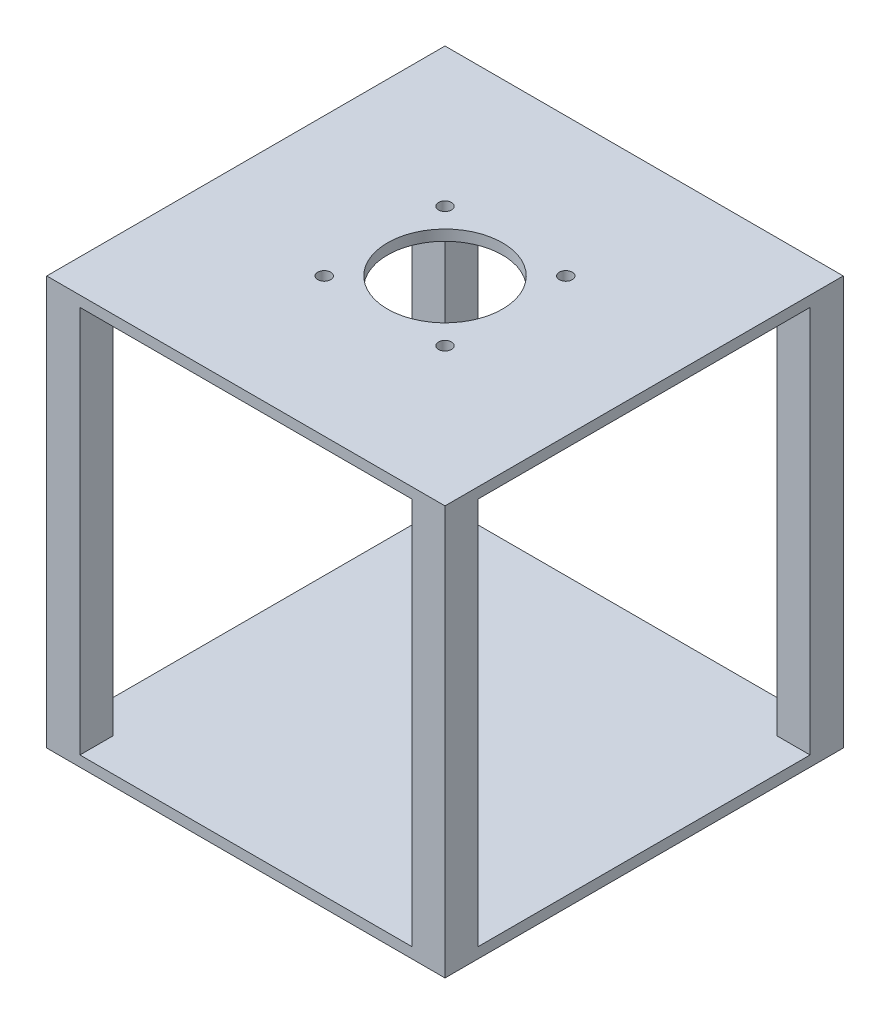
SolidWorks part; units mm, degrees
ref_plane "Front Plane" through (0, 0, 0) normal (0, 0, 1) x (1, 0, 0)
ref_plane "Top Plane" through (0, 0, 0) normal (0, 1, 0) x (1, 0, 0)
ref_plane "Right Plane" through (0, 0, 0) normal (1, 0, 0) x (0, 0, -1)
sketch "Sketch1" plane through (0, 0, 0) normal (0, 1, 0) x (1, 0, 0)
  line L1 (0, 0) -> (76.2, 0)
  line L2 (0, 0) -> (0, 76.2)
  line L3 (0, 76.2) -> (76.2, 76.2)
  line L4 (76.2, 0) -> (76.2, 76.2)
  dimension "D1" = 76.2
  dimension "D2" = 76.2
extrude "Boss-Extrude1" add sketch "Sketch1" along normal blind 2.032
sketch "Sketch2" plane through (0, 2.032, 0) normal (0, 1, 0) x (1, 0, 0)
  line L0 (0, 76.2) -> (0, 0) construction
  line L1 (76.2, 0) -> (76.2, 76.2) construction
  line L2 (76.2, 76.2) -> (0, 76.2) construction
  circle A0 centre (38.1, 38.1) radius 10.9982
  point P4 (0, 38.1)
  dimension "D3" = 21.9964
  dimension "D1" = 38.1
  dimension "D2" = 38.1
extrude "Cut-Extrude1" cut sketch "Sketch2" against normal through all
sketch "Sketch3" plane through (0, 0, 0) normal (0, -1, 0) x (1, 0, 0)
  line L0 (38.1, 0) -> (38.1, -76.2) construction
  line L1 (0, 0) -> (6.35, 0)
  line L2 (0, 0) -> (0, -6.35)
  line L3 (0, -6.35) -> (6.35, -6.35)
  line L4 (6.35, 0) -> (6.35, -6.35)
  line L5 (0, -76.2) -> (6.35, -76.2)
  line L6 (0, -76.2) -> (0, -69.85)
  line L7 (0, -69.85) -> (6.35, -69.85)
  line L8 (6.35, -76.2) -> (6.35, -69.85)
  line L9 (0, 0) -> (76.2, 0) construction
  line L10 (76.2, -76.2) -> (0, -76.2) construction
  line L11 (76.2, -76.2) -> (76.2, -69.85)
  line L12 (76.2, -76.2) -> (69.85, -76.2)
  line L13 (69.85, -76.2) -> (69.85, -69.85)
  line L14 (76.2, -69.85) -> (69.85, -69.85)
  line L15 (76.2, 0) -> (76.2, -6.35)
  line L16 (76.2, 0) -> (69.85, 0)
  line L17 (76.2, -6.35) -> (69.85, -6.35)
  line L18 (69.85, 0) -> (69.85, -6.35)
  dimension "D1" = 6.35
  dimension "D2" = 6.35
  dimension "D3" = 6.35
  dimension "D4" = 6.35
extrude "Boss-Extrude2" add sketch "Sketch3" along normal blind 76.2
sketch "Sketch4" plane through (0, -76.2, 0) normal (0, -1, 0) x (1, 0, 0)
  line L28 (76.2, -6.35) -> (69.85, -6.35)
  line L29 (69.85, -6.35) -> (69.85, 0)
  line L30 (69.85, 0) -> (6.35, 0)
  line L31 (6.35, 0) -> (6.35, -6.35)
  line L32 (6.35, -6.35) -> (0, -6.35)
  line L33 (0, -6.35) -> (0, -69.85)
  line L34 (0, -69.85) -> (6.35, -69.85)
  line L35 (6.35, -69.85) -> (6.35, -76.2)
  line L36 (6.35, -76.2) -> (69.85, -76.2)
  line L37 (69.85, -76.2) -> (69.85, -69.85)
  line L38 (69.85, -69.85) -> (76.2, -69.85)
  line L39 (76.2, -69.85) -> (76.2, -6.35)
  line L40 (76.2, -6.35) -> (69.85, -6.35)
  line L41 (69.85, -6.35) -> (69.85, 0)
  line L42 (69.85, 0) -> (6.35, 0)
  line L43 (6.35, 0) -> (6.35, -6.35)
  line L44 (6.35, -6.35) -> (0, -6.35)
  line L45 (0, -6.35) -> (0, -69.85)
  line L46 (0, -69.85) -> (6.35, -69.85)
  line L47 (6.35, -69.85) -> (6.35, -76.2)
  line L48 (6.35, -76.2) -> (69.85, -76.2)
  line L49 (69.85, -76.2) -> (69.85, -69.85)
  line L50 (69.85, -69.85) -> (76.2, -69.85)
  line L51 (76.2, -69.85) -> (76.2, -6.35)
  dimension "D1" = 0
extrude "Boss-Extrude3" add sketch "Sketch4" against normal blind 2.032
sketch "Sketch5" plane through (0, 2.032, 0) normal (0, 1, 0) x (1, 0, 0)
  line L0 (0, 76.2) -> (0, 0) construction
  line L3 (0, 0) -> (76.2, 0) construction
  circle A0 centre (26.543, 26.543) radius 1.2497
  circle A1 centre (26.543, 49.657) radius 1.2497
  circle A2 centre (49.657, 49.657) radius 1.2497
  circle A3 centre (49.657, 26.543) radius 1.2497
  point P8 (27.1463, 49.3081)
  point P9 (50.2523, 25.5885)
  point P10 (0, 0)
  point P11 (50.2603, 26.1941)
  point P12 (0, 0)
  dimension "D1" = 2.4994
  dimension "D2" = 23.114
  dimension "D3" = 23.114
  dimension "D4" = 23.114
  dimension "D5" = 23.114
  dimension "D6" = 26.543
  dimension "D7" = 26.543
  dimension "D8" = 26.543
  dimension "D9" = 26.543
extrude "Cut-Extrude2" cut sketch "Sketch5" against normal up to next
